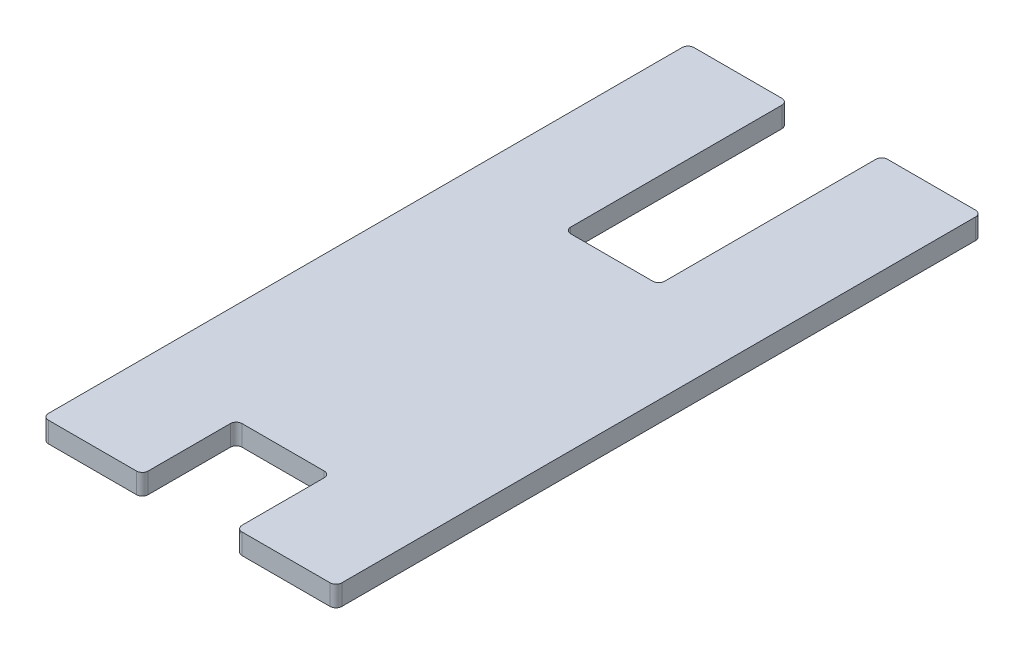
SolidWorks part; units mm, degrees
ref_plane "正面" through (0, 0, 0) normal (0, 0, 1) x (1, 0, 0)
ref_plane "平面" through (0, 0, 0) normal (0, 1, 0) x (1, 0, 0)
ref_plane "右側面" through (0, 0, 0) normal (1, 0, 0) x (0, 0, -1)
sketch "ｽｹｯﾁ1" plane through (0, 0, 0) normal (0, 1, 0) x (1, 0, 0)
  line L0 (8, 0) -> (25, 0)
  line L1 (-25, 110) -> (-8, 110)
  line L2 (-25, 110) -> (-25, 0)
  line L3 (-25, 0) -> (-8, 0)
  line L4 (25, 110) -> (25, 0)
  line L5 (-8, 16) -> (8, 16)
  line L6 (-8, 16) -> (-8, 0)
  line L8 (8, 16) -> (8, 0)
  line L10 (-8, 110) -> (-8, 72)
  line L11 (-8, 72) -> (8, 72)
  line L12 (8, 110) -> (8, 72)
  line L13 (8, 110) -> (25, 110)
  line L14 (0, 0) -> (0, 113.1187) construction
  dimension "D1" = 50
  dimension "D2" = 16
  dimension "D3" = 38
  dimension "D4" = 110
  dimension "D5" = 16
extrude "ﾎﾞｽ - 押し出し1" add sketch "ｽｹｯﾁ1" along normal blind 3.5
fillet "ﾌｨﾚｯﾄ1" radius 1 12 edges at (-25, 1.75, -110) (-8, 1.75, -110) (-8, 1.75, -72) (8, 1.75, -72) (8, 1.75, -110) (25, 1.75, -110) (8, 1.75, 0) (8, 1.75, -16) (-8, 1.75, -16) (-8, 1.75, 0) (-25, 1.75, 0) (25, 1.75, 0)
